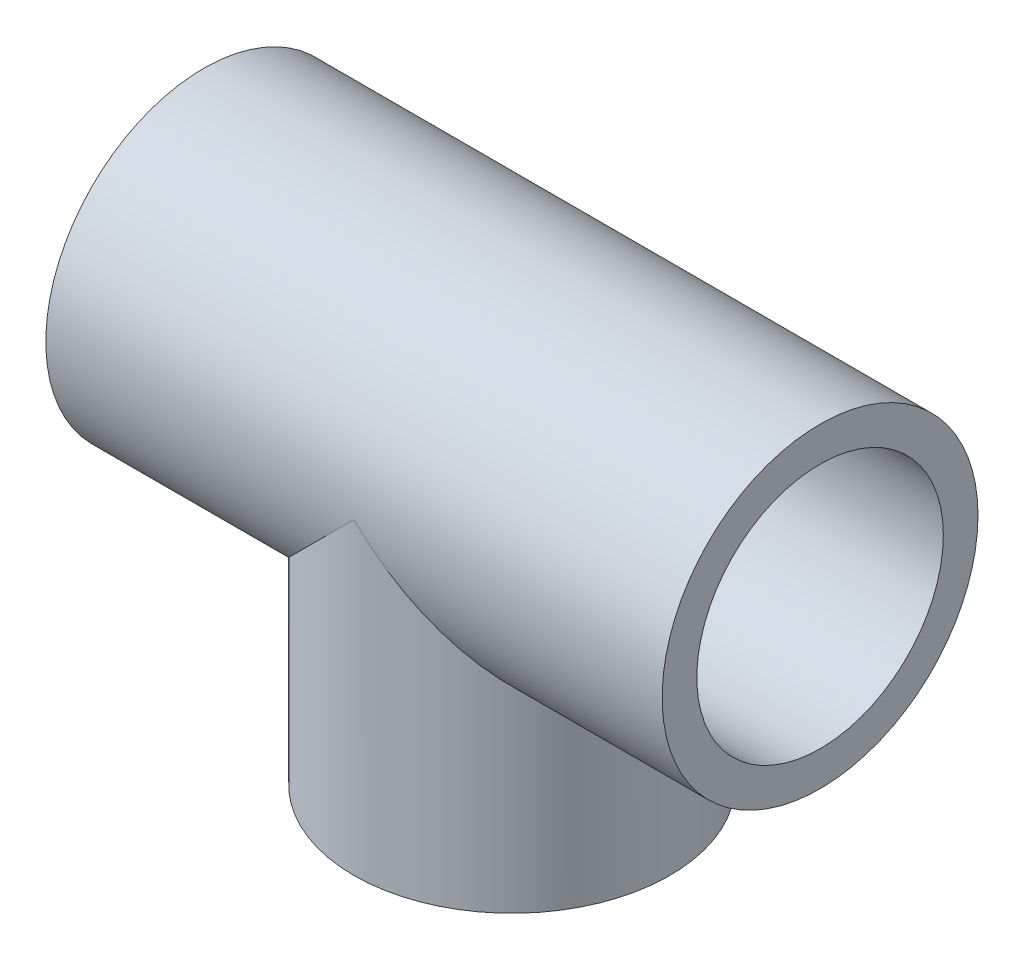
SolidWorks part; units mm, degrees
ref_plane "Front Plane" through (0, 0, 0) normal (0, 0, 1) x (1, 0, 0)
ref_plane "Top Plane" through (0, 0, 0) normal (0, 1, 0) x (1, 0, 0)
ref_plane "Right Plane" through (0, 0, 0) normal (1, 0, 0) x (0, 0, -1)
sketch "Sketch1" plane through (0, 0, 0) normal (1, 0, 0) x (0, 0, -1)
  circle A0 centre (0, 0) radius 16
  dimension "D1" = 32
extrude "Boss-Extrude1" add sketch "Sketch1" along normal mid plane 80
sketch "Sketch2" plane through (0, 0, 0) normal (0, 1, 0) x (1, 0, 0)
  circle A0 centre (0, 0) radius 16
  dimension "D1" = 32
extrude "Boss-Extrude2" add sketch "Sketch2" against normal blind 40
shell "Shell1" thickness 4.5
ref_plane "Plane1" through (-20, 0, 0) normal (-1, 0, 0) x (0, 0, 1)
ref_plane "Plane2" through (20, 0, 0) normal (1, 0, 0) x (0, 0, -1)
ref_plane "Plane3" through (0, -20, 0) normal (0, -1, 0) x (-1, 0, 0)
other "Smart-Feature1<PVC pipe 3 way-1>"
